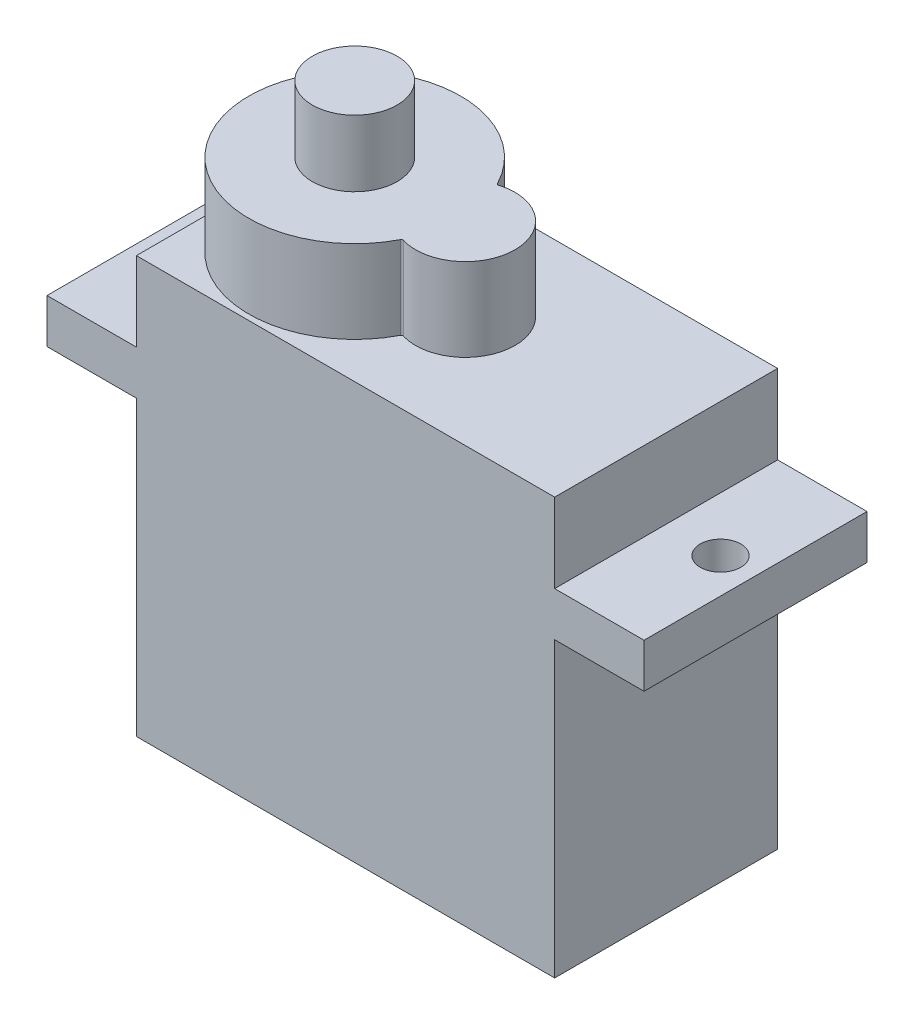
SolidWorks part; units mm, degrees
ref_plane "Front Plane" through (0, 0, 0) normal (0, 0, 1) x (1, 0, 0)
ref_plane "Top Plane" through (0, 0, 0) normal (0, 1, 0) x (1, 0, 0)
ref_plane "Right Plane" through (0, 0, 0) normal (1, 0, 0) x (0, 0, -1)
sketch "Sketch1" plane through (0, 0, 0) normal (0, 0, 1) x (1, 0, 0)
  line L0 (0, -4.3) -> (-4.85, -4.3)
  line L1 (0, 0) -> (22.7, 0)
  line L2 (0, 0) -> (0, -4.3)
  line L3 (0, -22.6) -> (22.7, -22.6)
  line L4 (22.7, 0) -> (22.7, -4.3)
  line L5 (-4.85, -4.3) -> (-4.85, -6.7)
  line L6 (-4.85, -6.7) -> (0, -6.7)
  line L7 (22.7, -6.7) -> (22.7, -22.6)
  line L8 (27.55, -6.7) -> (22.7, -6.7)
  line L9 (27.55, -4.3) -> (27.55, -6.7)
  line L10 (22.7, -4.3) -> (27.55, -4.3)
  line L11 (0, -6.7) -> (0, -22.6)
  dimension "D1" = 22.7
  dimension "D2" = 22.6
  dimension "D3" = 4.3
  dimension "D4" = 4.85
  dimension "D5" = 2.4
  dimension "D6" = 4.85
  dimension "D7" = 2.4
  dimension "D8" = 4.3
extrude "Boss-Extrude1" add sketch "Sketch1" along normal blind 12.1
sketch "Sketch3" plane through (0, -4.3, 0) normal (0, 1, 0) x (1, 0, 0)
  line L0 (0, -12.1) -> (-4.85, -12.1) construction
  line L1 (-4.85, -12.1) -> (-4.85, 0) construction
  line L2 (0, 0) -> (-4.85, 0) construction
  circle A0 centre (-2.95, -6.05) radius 1.1
  circle A1 centre (25.65, -6.05) radius 1.1
  dimension "D" = 2.2
  dimension "D1" = 6.05
  dimension "D2" = 1.9
  dimension "D3" = 6.05
  dimension "D5" = 30.5
extrude "Cut-Extrude1" cut sketch "Sketch3" against normal blind 12.1
sketch "Sketch4" plane through (0, 0, 0) normal (0, 1, 0) x (1, 0, 0)
  arc A0 (10.9477, -3.488) -> (10.9477, -8.612) centre (5.8, -6.05) ccw
  circle A1 centre (-2.95, -6.05) radius 1.1 construction
  arc A2 (10.9477, -8.612) -> (10.9477, -3.488) centre (11.8, -6.05) ccw
  dimension "D2" = 11.5
  dimension "D3" = 5.4
  dimension "D1" = 8.75
  dimension "D4" = 6
extrude "Boss-Extrude2" add sketch "Sketch4" along normal blind 4.5
fillet "Fillet1" radius 0.1 2 edges at (10.9477, 2.25, 8.612) (10.9477, 2.25, 3.488)
sketch "Sketch5" plane through (0, 4.5, 0) normal (0, 1, 0) x (1, 0, 0)
  circle A0 centre (5.8, -6.05) radius 2.3
  dimension "D1" = 4.6
extrude "Boss-Extrude3" add sketch "Sketch5" along normal blind 3.6
